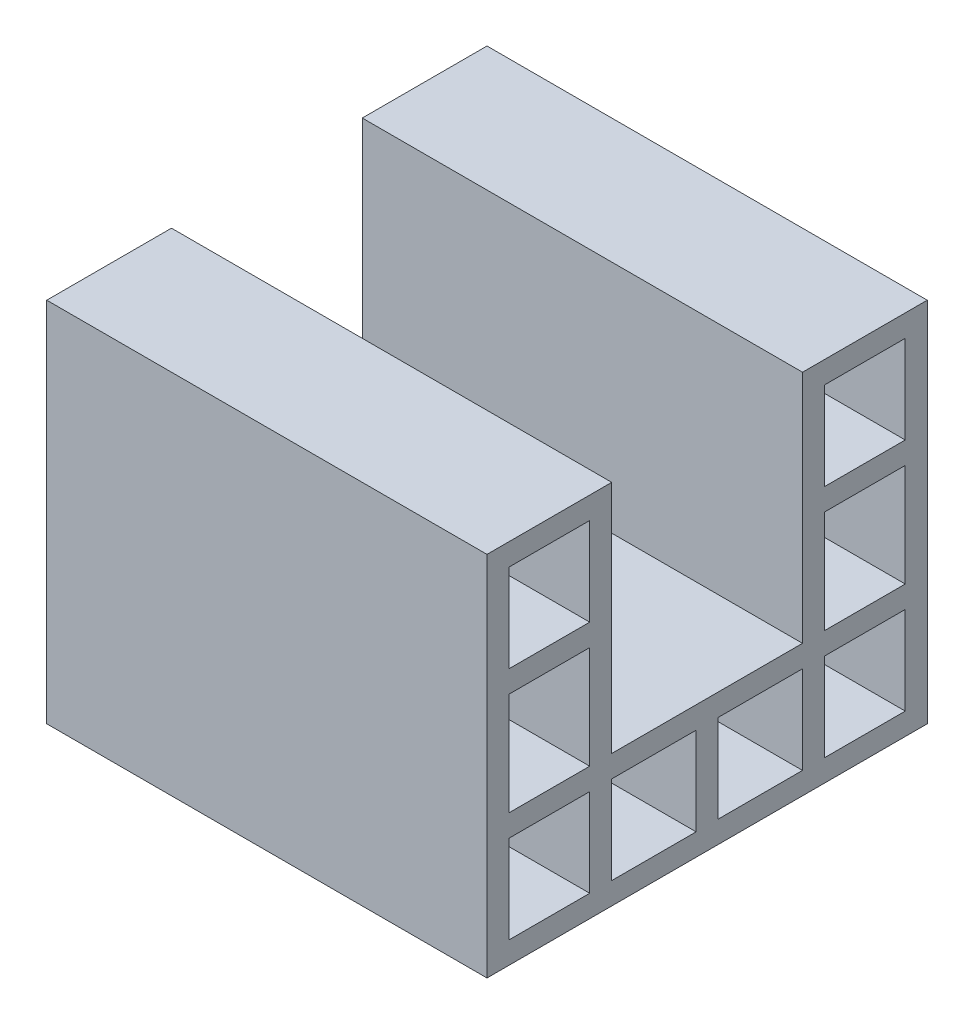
SolidWorks part; units mm, degrees
ref_plane "Face" through (0, 0, 0) normal (0, 0, 1) x (1, 0, 0)
ref_plane "Dessus" through (0, 0, 0) normal (0, 1, 0) x (1, 0, 0)
ref_plane "Droite" through (0, 0, 0) normal (1, 0, 0) x (0, 0, -1)
sketch "Esquisse1" plane through (0, 0, 0) normal (1, 0, 0) x (0, 0, -1)
  line L0 (-6.3934, 0) -> (65.9739, 0) construction
  line L1 (0, -8.3606) -> (0, 56.0651) construction
  line L2 (-6.3934, 25) -> (65.9739, 25) construction
  line L3 (30, -8.3606) -> (30, 56.0651) construction
  line L4 (15, 50.677) -> (15, -8.3606) construction
  line L5 (1.5, 31.0798) -> (1.5, -8.3606) construction
  line L6 (7, 31.0798) -> (7, -8.3606) construction
  line L7 (8.5, 31.0798) -> (8.5, -8.3606) construction
  line L8 (-1.3914, 12.5) -> (59.6308, 12.5) construction
  line L9 (-6.3934, 1.5) -> (31.1461, 1.5) construction
  line L10 (-6.3934, 7.5) -> (33.9897, 7.5) construction
  line L11 (-6.3934, 9) -> (33.9897, 9) construction
  line L12 (8.5, 9) -> (8.5, 25)
  line L13 (14.25, -8.3606) -> (14.25, 10.7738) construction
  line L14 (1.5, 16) -> (7, 16)
  line L15 (1.5, 7.5) -> (7, 7.5)
  line L16 (1.5, 7.5) -> (1.5, 1.5)
  line L17 (1.5, 1.5) -> (7, 1.5)
  line L18 (7, 7.5) -> (7, 1.5)
  line L19 (7, 17.5) -> (7, 23.5)
  line L20 (1.5, 16) -> (1.5, 9)
  line L21 (1.5, 9) -> (7, 9)
  line L22 (7, 16) -> (7, 9)
  line L23 (1.5, 23.5) -> (7, 23.5)
  line L24 (1.5, 17.5) -> (1.5, 23.5)
  line L25 (1.5, 17.5) -> (7, 17.5)
  line L26 (8.5, 7.5) -> (14.25, 7.5)
  line L27 (8.5, 7.5) -> (8.5, 1.5)
  line L28 (8.5, 1.5) -> (14.25, 1.5)
  line L29 (14.25, 7.5) -> (14.25, 1.5)
  line L30 (8.5, 25) -> (0, 25)
  line L31 (0, 25) -> (0, 0)
  line L32 (21.5, 25) -> (30, 25)
  line L33 (21.5, 9) -> (21.5, 25)
  line L34 (30, 25) -> (30, 0)
  line L35 (15.75, 7.5) -> (15.75, 1.5)
  line L36 (21.5, 1.5) -> (15.75, 1.5)
  line L37 (21.5, 7.5) -> (21.5, 1.5)
  line L38 (21.5, 7.5) -> (15.75, 7.5)
  line L39 (28.5, 17.5) -> (23, 17.5)
  line L40 (28.5, 17.5) -> (28.5, 23.5)
  line L41 (28.5, 23.5) -> (23, 23.5)
  line L42 (23, 16) -> (23, 9)
  line L43 (28.5, 9) -> (23, 9)
  line L44 (28.5, 16) -> (28.5, 9)
  line L45 (23, 17.5) -> (23, 23.5)
  line L46 (23, 7.5) -> (23, 1.5)
  line L47 (28.5, 1.5) -> (23, 1.5)
  line L48 (28.5, 7.5) -> (28.5, 1.5)
  line L49 (28.5, 7.5) -> (23, 7.5)
  line L50 (28.5, 16) -> (23, 16)
  line L51 (8.5, 9) -> (21.5, 9)
  line L52 (0, 0) -> (30, 0)
  dimension "D1" = 30
  dimension "D2" = 25
  dimension "D3" = 15
  dimension "D4" = 12.5
  dimension "D5" = 1.5
  dimension "D6" = 1.5
  dimension "D7" = 1.5
  dimension "D9" = 1.5
  dimension "D10" = 6
  dimension "D11" = 5.5
  dimension "D12" = 0.75
extrude "Extrusion1" add sketch "Esquisse1" along normal blind 30
draft "Dépouille1" type of draft neutral plane draft angle 1 faces to draft 32 parameters "D1"=1
